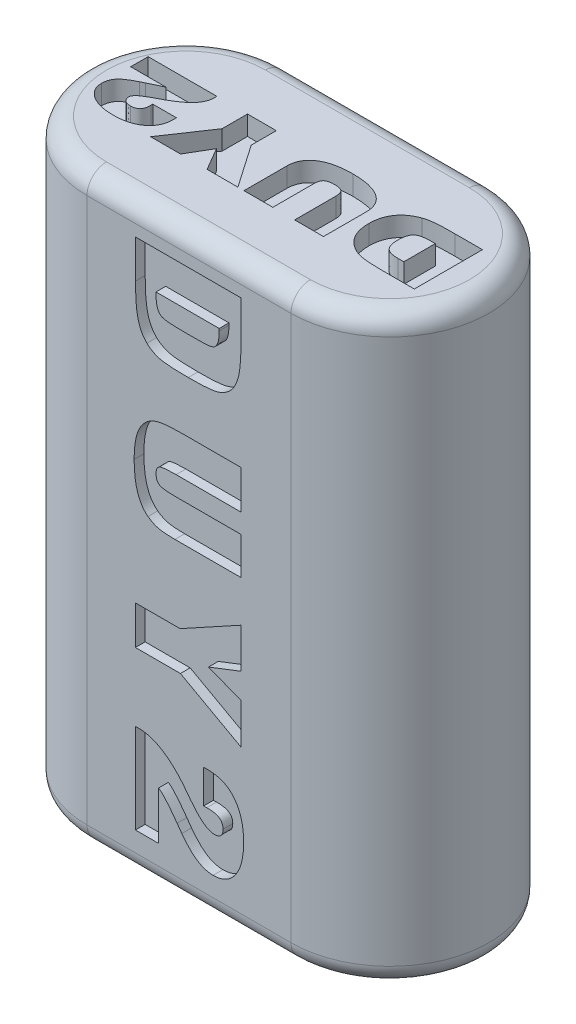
SolidWorks part; units mm, degrees
ref_plane "Front Plane" through (0, 0, 0) normal (0, 0, 1) x (1, 0, 0)
ref_plane "Top Plane" through (0, 0, 0) normal (0, 1, 0) x (1, 0, 0)
ref_plane "Right Plane" through (0, 0, 0) normal (1, 0, 0) x (0, 0, -1)
sketch3d "3DSketch1" plane through (0, 0, 0) normal (0, 0, 1) x (1, 0, 0)
sketch "Main Outline" plane through (0, 0, 0) normal (0, 1, 0) x (1, 0, 0)
  line L6 (15.2562, 6.5669) -> (4.7777, 6.5669) construction
  line L7 (15.2562, 1.4809) -> (4.7777, 1.4809)
  line L8 (15.2562, 11.6529) -> (4.7777, 11.6529)
  arc A0 (15.2562, 1.4809) -> (15.2562, 11.6529) centre (15.2562, 6.5669) ccw
  arc A1 (4.7777, 11.6529) -> (4.7777, 1.4809) centre (4.7777, 6.5669) ccw
  point P5 (10.0169, 6.5669)
sketch "USB Hole" plane through (0, 0, 0) normal (0, -1, 0) x (-1, 0, 0)
  line L5 (-17.4253, 9.8333) -> (-2.6086, 9.8333)
  line L6 (-17.4253, 9.8333) -> (-17.4253, 3.3005)
  line L7 (-17.4253, 3.3005) -> (-2.6086, 3.3005)
  line L8 (-2.6086, 9.8333) -> (-2.6086, 3.3005)
extrude "Boss-Extrude1" add sketch "Main Outline" along normal blind 30
extrude "Cut-Extrude1" cut sketch "USB Hole" against normal blind 5
fillet "Round the bottom" radius 1 4 edges at (-0.3083, 30, -6.5669) (10.0169, 30, -11.6529) (20.3422, 30, -6.5669) (10.0169, 30, -1.4809)
sketch "Bottom Text Line" plane through (0, 30, 0) normal (0, 1, 0) x (1, 0, 0)
  line L0 (19.3422, 8.2327) -> (0.6917, 8.2327)
sketch "Bottom Text" plane through (0, 30, 0) normal (0, 1, 0) x (1, 0, 0)
  text T0 "<b>DUY2</b>" font "Swis721 Blk BT" height 3.5
extrude "Bottom Text Cut" cut sketch "Bottom Text" against normal blind 1
sketch "Side 1 Text Line" plane through (0, 0, -1.4809) normal (0, 0, 1) x (1, 0, 0)
  line L0 (7.2652, 29) -> (7.2652, 1.5347)
  line L1 (15.2562, 29) -> (4.7777, 29) construction
sketch "Side 1 Text" plane through (0, 0, -1.4809) normal (0, 0, 1) x (1, 0, 0)
  text T0 "<b>DUY2</b>" font "Swis721 BlkCn BT" height in points 20
extrude "Cut Text 1" cut sketch "Side 1 Text" against normal blind 0.5
sketch "Side 2 Text Line" plane through (0, 0, -11.6529) normal (0, 0, -1) x (-1, 0, 0)
  line L0 (-7.2652, 1.5347) -> (-7.2652, 29)
sketch "Side 2 Text" plane through (0, 0, -11.6529) normal (0, 0, -1) x (-1, 0, 0)
  text T0 "<b>DUY2</b>" font "Swis721 BlkCn BT" height in points 20
extrude "Cut Text 2" cut sketch "Side 2 Text" against normal blind 0.5
fillet "Round the top" radius 1 4 edges at (10.0169, 0, -11.6529) (20.3422, 0, -6.5669) (10.0169, 0, -1.4809) (-0.3083, 0, -6.5669)
sketch "Magnet Profile" plane through (0, 5, 0) normal (0, -1, 0) x (1, 0, 0)
  line L0 (4.9587, -3.7941) -> (15.2161, -3.7941)
  line L1 (4.9587, -3.7941) -> (4.9587, -9.1287)
  line L2 (4.9587, -9.1287) -> (15.2161, -9.1287)
  line L3 (15.2161, -3.7941) -> (15.2161, -9.1287)
  line L4 (4.9587, -3.7941) -> (15.2161, -9.1287) construction
  line L5 (4.9587, -9.1287) -> (15.2161, -3.7941) construction
  point P0 (10.0874, -6.4614)
extrude "Cut-Extrude2" cut sketch "Magnet Profile" against normal blind 19.5
